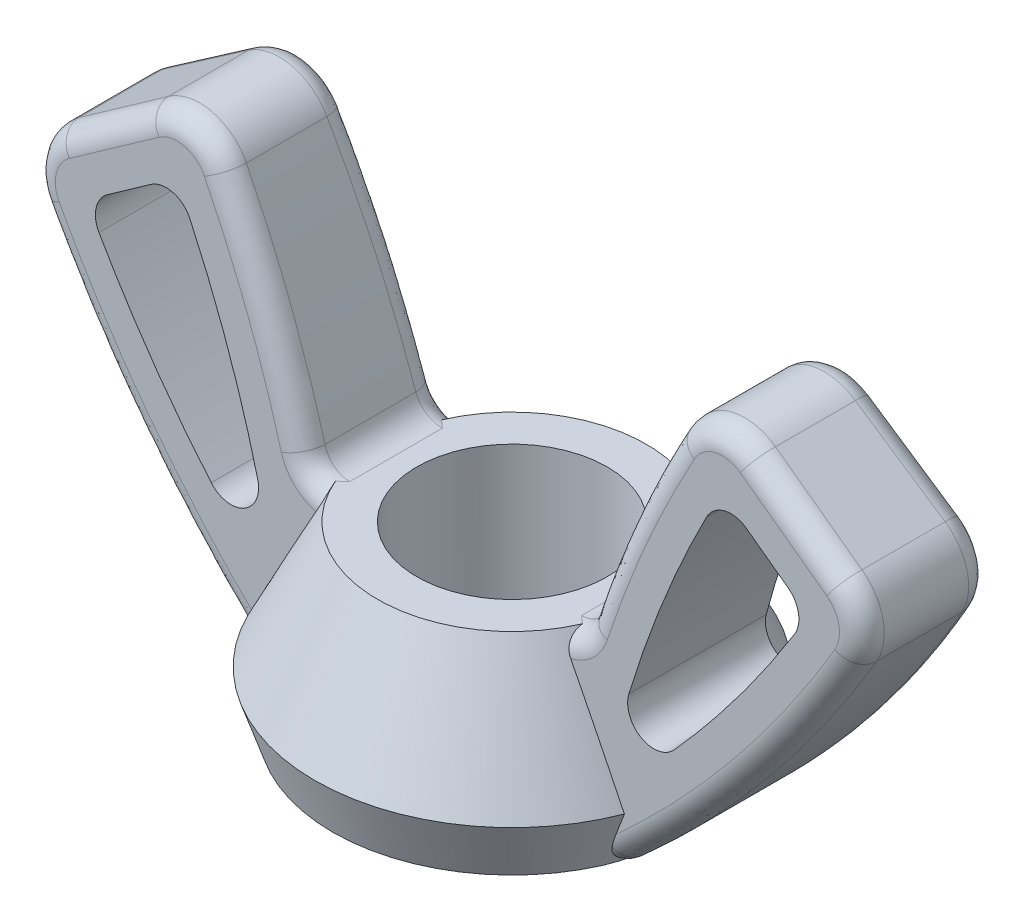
SolidWorks part; units mm, degrees
ref_plane "Front Plane" through (0, 0, 0) normal (0, 0, 1) x (1, 0, 0)
ref_plane "Top Plane" through (0, 0, 0) normal (0, 1, 0) x (1, 0, 0)
ref_plane "Right Plane" through (0, 0, 0) normal (1, 0, 0) x (0, 0, -1)
sketch "BaseNutSke" plane through (0, 0, 0) normal (0, 0, 1) x (1, 0, 0)
  line L0 (0, 0) -> (-8, 0)
  line L2 (-6, 8) -> (0, 8)
  line L3 (0, 8) -> (0, 0)
  line L4 (0, -38.5148) -> (0, 38.5148) construction
  line L5 (-6, 8) -> (-8.8, 2.4)
  line L6 (-8.8, 2.4) -> (-8, 0)
  dimension "D1" = 5.6
  dimension "Top_Width" = 12
  dimension "D2" = 17.6
  dimension "Bottom_Width" = 16
  dimension "Nut_Height" = 8
revolve "BaseNut" add sketch "BaseNutSke" angle 360 about L4
sketch "BaseWingSke" plane through (0, 0, 0) normal (1, 0, 0) x (0, 0, -1)
  line L0 (0, 0) -> (0, 62.8635) construction
  line L1 (-2.75, 19) -> (-3.25, 0)
  line L2 (-2.75, 19) -> (2.75, 19)
  line L3 (2.75, 19) -> (3.25, 0)
  line L4 (3.25, 0) -> (-3.25, 0)
  point P8 (0, 19)
  dimension "TopWing_Width" = 5.5
  dimension "BottomWing_Width" = 6.5
  dimension "Height" = 19
extrude "BaseWing" add sketch "BaseWingSke" along normal mid plane 37
sketch "CutWingSke" plane through (0, 0, 0) normal (0, 0, 1) x (1, 0, 0)
  line L0 (0, 0) -> (0, 84.5075) construction
  line L3 (18.5, 19) -> (-18.5, 19) construction
  line L4 (-18.5, 19) -> (-18.5, 0) construction
  line L5 (-7.3101, 0) -> (7.3101, 0) construction
  line L6 (5.1732, 8) -> (-5.1732, 8) construction
  line L7 (13.5447, 18.566) -> (17.4766, 15.8128)
  line L8 (-13.5447, 18.566) -> (-17.4766, 15.8128)
  line L9 (-7.3101, 0) -> (-18.5, 0) construction
  line L10 (-28.5, 29) -> (28.5, 29)
  line L11 (-28.5, 29) -> (-28.5, -10)
  line L12 (-28.5, -10) -> (28.5, -10)
  line L13 (28.5, 29) -> (28.5, -10)
  line L14 (18.5, 19) -> (18.5, 0) construction
  line L16 (-7.3101, 0) -> (7.3101, 0)
  line L17 (5.1732, 8) -> (-5.1732, 8)
  arc A0 (-5.1732, 8) -> (-6.3192, 8.8442) centre (-5.1732, 9.2) cw
  arc A1 (-7.3101, 0) -> (-8.1072, 0.303) centre (-7.3101, 1.2) cw
  arc A2 (-17.4766, 15.8128) -> (-18.1775, 12.6452) centre (-16.1, 13.8468) ccw
  arc A3 (-10.0553, 17.7386) -> (-13.5447, 18.566) centre (-12.1681, 16.6) ccw
  arc A4 (-10.0553, 17.7386) -> (-6.3192, 8.8442) centre (-54.0704, -5.9821) cw
  arc A5 (-18.1775, 12.6452) -> (-8.1072, 0.303) centre (25.1037, 37.68) ccw
  arc A6 (7.3101, 0) -> (8.1072, 0.303) centre (7.3101, 1.2) ccw
  arc A7 (18.1775, 12.6452) -> (8.1072, 0.303) centre (-25.1037, 37.68) cw
  arc A8 (17.4766, 15.8128) -> (18.1775, 12.6452) centre (16.1, 13.8468) cw
  arc A9 (10.0553, 17.7386) -> (13.5447, 18.566) centre (12.1681, 16.6) cw
  arc A10 (10.0553, 17.7386) -> (6.3192, 8.8442) centre (54.0704, -5.9821) ccw
  arc A11 (5.1732, 8) -> (6.3192, 8.8442) centre (5.1732, 9.2) ccw
  dimension "D5" = 1.2
  dimension "D6" = 50
  dimension "D7" = 2.4
  dimension "D1" = 10
  dimension "D2" = 10
  dimension "D3" = 10
  dimension "D4" = 10
  dimension "D8" = 35
  dimension "D9" = 4.8
extrude "CutWing" cut sketch "CutWingSke" against normal mid plane 37
sketch "HoleSke" plane through (0, 0, 0) normal (0, 1, 0) x (1, 0, 0)
  circle A0 centre (0, 0) radius 4.25
  dimension "Tap_drill" = 8.5
extrude "TappedHole" cut sketch "HoleSke" along normal through all
chamfer "Chamfer1" distance 0.5667 angle 60 1 edges at (0, 0, 4.25)
sketch "HollowSke" plane through (0, 0, 0) normal (0, 0, 1) x (1, 0, 0)
  line L0 (-13.2891, 15.815) -> (-15.1878, 14.4855)
  line L1 (13.2891, 15.815) -> (15.1878, 14.4855)
  line L2 (-13.5447, 18.566) -> (-17.4766, 15.8128) construction
  line L3 (0, 0) -> (0, 22.0794) construction
  arc A0 (-11.5283, 15.3704) -> (-8.282, 7.0249) centre (-54.0704, -5.9821) cw
  arc A1 (-15.5238, 12.8773) -> (-10.3296, 5.8957) centre (25.1037, 37.68) ccw
  arc A4 (-6.3192, 8.8442) -> (-10.0553, 17.7386) centre (-54.0704, -5.9821) ccw construction
  arc A5 (-18.1775, 12.6452) -> (-8.1072, 0.303) centre (25.1037, 37.68) ccw construction
  arc A6 (-13.2891, 15.815) -> (-11.5283, 15.3704) centre (-12.6008, 14.8321) cw
  arc A7 (-15.1878, 14.4855) -> (-15.5238, 12.8773) centre (-14.4995, 13.5026) ccw
  arc A8 (-8.282, 7.0249) -> (-10.3296, 5.8957) centre (-9.4364, 6.697) cw
  arc A9 (8.282, 7.0249) -> (10.3296, 5.8957) centre (9.4364, 6.697) ccw
  arc A10 (15.5238, 12.8773) -> (10.3296, 5.8957) centre (-25.1037, 37.68) cw
  arc A11 (15.1878, 14.4855) -> (15.5238, 12.8773) centre (14.4995, 13.5026) cw
  arc A12 (13.2891, 15.815) -> (11.5283, 15.3704) centre (12.6008, 14.8321) ccw
  arc A13 (11.5283, 15.3704) -> (8.282, 7.0249) centre (54.0704, -5.9821) ccw
  dimension "D1" = 2.4
  dimension "D2" = 2.4
  dimension "D4" = 1.2
  dimension "D3" = 2.4
extrude "HollowWing" cut sketch "HollowSke" against normal mid plane 10
fillet "Fillet1" radius 1 28 edges at (7.7364, 0.0783, -3.2479) (13.637, 6.0704, -3.0903) (18.4433, 14.3653, -2.872) (15.5106, 17.1894, -2.7976) (11.6143, 18.9352, -2.7517) (5.8849, 8.2338, -3.0333) (5.8849, 8.2338, 3.0333) (7.7364, 0.0783, 3.2479) (13.637, 6.0704, 3.0903) (18.4433, 14.3653, 2.872) (15.5106, 17.1894, 2.7976) (11.6143, 18.9352, 2.7517) (-5.8849, 8.2338, -3.0333) (-7.7364, 0.0783, -3.2479) (-13.637, 6.0704, -3.0903) (-18.4433, 14.3653, -2.872) (-15.5106, 17.1894, -2.7976) (-11.6143, 18.9352, -2.7517) (-7.7364, 0.0783, 3.2479) (-13.637, 6.0704, 3.0903) (-18.4433, 14.3653, 2.872) (-15.5106, 17.1894, 2.7976) (-11.6143, 18.9352, 2.7517) (-5.8849, 8.2338, 3.0333) (7.9723, 13.3817, -2.8978) (7.9723, 13.3817, 2.8978) (-7.9723, 13.3817, -2.8978) (-7.9723, 13.3817, 2.8978)
sketch "ThdSchSke" plane through (0, 0, 0) normal (0, 0, 1) x (1, 0, 0)
  line L0 (4.25, 0.5667) -> (3.384, 0.5667)
  line L1 (3.384, 0.5667) -> (3.384, 1.4327)
  line L2 (3.384, 1.4327) -> (4.25, 1.4327)
  line L3 (4.25, 1.4327) -> (5, 0.9997)
  line L4 (5, 0.9997) -> (4.25, 0.5667)
  line L5 (0, -3.4614) -> (0, 8.4929) construction
  line L6 (-4.25, 0.5667) -> (4.25, 0.5667) construction
  dimension "D1" = 8.5
  dimension "ThreadN" = 10
revolve "ThreadSchematic" [suppressed] cut sketch "ThdSchSke" angle 360 about L5
pattern_linear "ThdSchPat" [suppressed]
equation "\"D1@BaseNutSke\" = \"Nut_Height@BaseNutSke\"*0.7"
equation "\"D2@BaseNutSke\" = \"Bottom_Width@BaseNutSke\"*1.1"
equation "\"D5@CutWingSke\" = \"Top_Width@BaseNutSke\"/10"
equation "\"D7@CutWingSke\" = \"Top_Width@BaseNutSke\"*0.2"
equation "\"D9@CutWingSke\" = \"Top_Width@BaseNutSke\"*0.4"
equation "\"D1@CutWing\" = \"Width@BaseWing\""
equation "\"D1@Chamfer1\" = \"Tap_drill@HoleSke\"/15"
equation "\"D1@HollowSke\" = \"Top_Width@BaseNutSke\"/5"
equation "\"D2@HollowSke\" = \"Top_Width@BaseNutSke\"/5"
equation "\"D3@HollowSke\" = \"Top_Width@BaseNutSke\"/5"
equation "\"D4@HollowSke\" = \"Top_Width@BaseNutSke\"/10"
equation "\"D1@Fillet1\" = \"Top_Width@BaseNutSke\"/12"
equation "\"D1@ThdSchSke\" = \"Tap_drill@HoleSke\""
equation "\"ThreadN@ThdSchSke\"=\"Thread_major@ThreadCosmetic\""
equation "\"Num_threads@ThdSchPat\" = int( \"Nut_Height@BaseNutSke\"/\"Advance@ThdSchPat\" ) +1"
